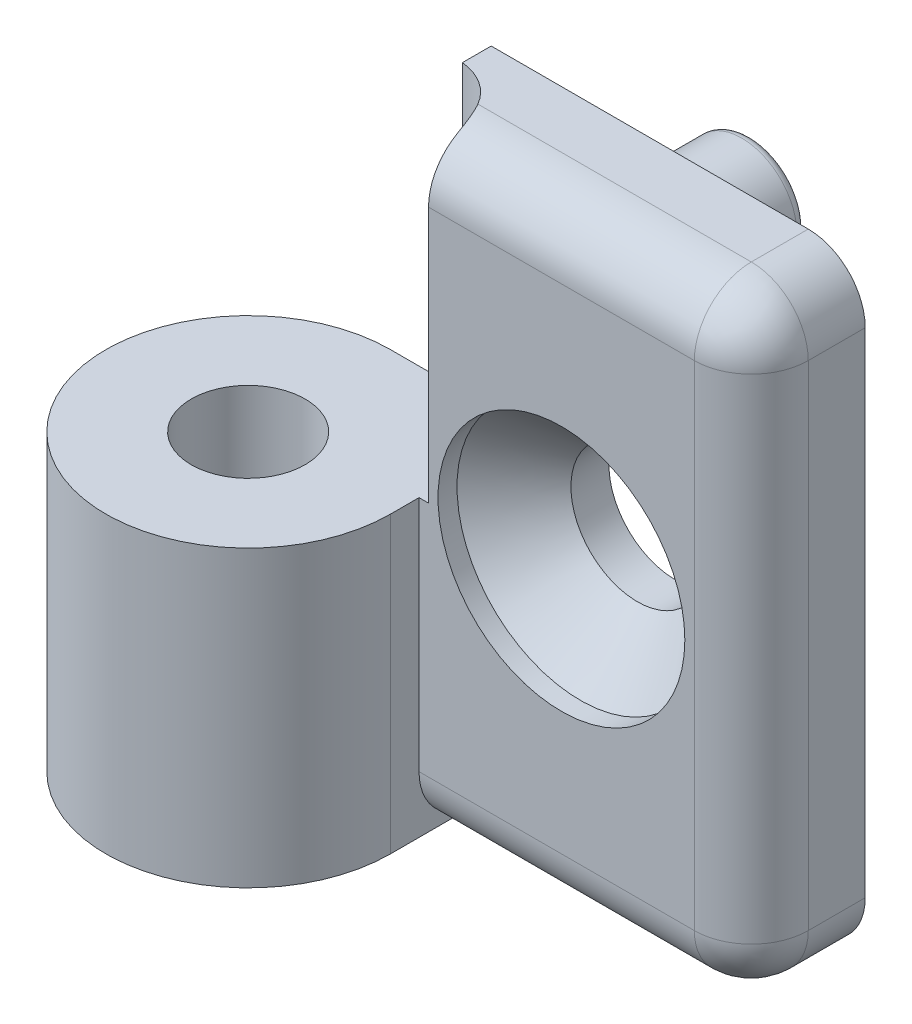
SolidWorks part; units mm, degrees
ref_plane "正面" through (0, 0, 0) normal (0, 0, 1) x (1, 0, 0)
ref_plane "平面" through (0, 0, 0) normal (0, 1, 0) x (1, 0, 0)
ref_plane "右側面" through (0, 0, 0) normal (1, 0, 0) x (0, 0, -1)
sketch "ｽｹｯﾁ1" plane through (0, 0, 0) normal (0, 1, 0) x (1, 0, 0)
  line L11 (7.6, 7.5) -> (0, 7.5)
  line L12 (7.5, 0) -> (7.5, 1.5)
  line L13 (7.6, 7.5) -> (7.6, 1.5)
  line L14 (7.6, 1.5) -> (7.5, 1.5)
  arc A6 (0, 7.5) -> (7.5, 0) centre (0, 0) ccw
  dimension "D1" = 0.1
extrude "押し出し1" add sketch "ｽｹｯﾁ1" along normal blind 15.5
sketch "ｽｹｯﾁ2" plane through (0, 0, 0) normal (0, -1, 0) x (1, 0, 0)
  line L0 (5.3, -1.5) -> (5.3, -7.5)
  line L14 (25, -7.5) -> (5.3, -7.5)
  line L15 (22, -1.5) -> (5.3, -1.5)
  line L16 (25, -4.5) -> (25, -7.5)
  arc A2 (25, -4.5) -> (22, -1.5) centre (22, -4.5) ccw
  dimension "D1" = 3
  dimension "D2" = 6
  dimension "D4" = 5.3
extrude "押し出し10" add sketch "ｽｹｯﾁ2" against normal blind 32
hole_wizard "穴1" positions "3Dｽｹｯﾁ1" profile "ｽｹｯﾁ6" legacy
sketch3d "3Dｽｹｯﾁ1"
  line L2 (22, 32, -1.5) -> (5.3, 32, -1.5) construction
  line L5 (22, 32, -1.5) -> (22, 0, -1.5) construction
  point P2 (15, 16, -1.5)
  dimension "D4" = 7
  dimension "D3" = 16
sketch "ｽｹｯﾁ6" plane through (15, 16, -1.5) normal (1, 0, 0) x (0, -1, 0)
  line L0 (0, 0) -> (0, 6)
  line L1 (0, 6) -> (3.5, 6)
  line L2 (3.5, 6) -> (3.5, 4)
  line L3 (3.5, 4) -> (6.5, 1)
  line L4 (6.5, 1) -> (6.5, 0)
  line L6 (6.5, 0) -> (0, 0)
  line L7 (-3.5, 4) -> (-6.5, 1) construction
  line L11 (0, -6.35) -> (0, 107.95) construction
  dimension "通し穴の直径" = 7
  dimension "通し穴の深さ" = 6
  dimension "皿穴の直径" = 13
  dimension "皿穴の角度" = 90
  dimension "ねじのすきま" = 1
sketch "ｽｹｯﾁ8" plane through (0, 0, -7.5) normal (0, 0, -1) x (-1, 0, 0)
  line L1 (-25, 32) -> (-25, 0) construction
  circle A2 centre (-15, 4) radius 2.9
  circle A9 centre (-15, 28) radius 2.9
  dimension "D1" = 10
  dimension "D2" = 5.8
  dimension "D3" = 5.8
fillet "ﾌｨﾚｯﾄ1" radius 3 6 edges at (25, 32, -6) (24.1213, 32, -2.3787) (13.65, 32, -1.5) (25, 0, -6) (24.1213, 0, -2.3787) (14.75, 0, -1.5)
sketch "ｽｹｯﾁ9" plane through (0, 32, 0) normal (0, 1, 0) x (1, 0, 0)
  line L1 (25, 7.5) -> (25, 4.5) construction
  line L2 (22, 7.5) -> (5.3, 7.5) construction
  line L3 (8, 3) -> (8, 0)
  line L4 (5, 0) -> (8, 0)
  arc A0 (8, 3) -> (5, 0) centre (5, 3) ccw
  dimension "D1" = 6
  dimension "D2" = 20
  dimension "D3" = 4.5
extrude "ｶｯﾄ - 押し出し1" cut sketch "ｽｹｯﾁ9" against normal blind 16.5
sketch "ｽｹｯﾁ10" plane through (0, 15.5, 0) normal (0, 1, 0) x (1, 0, 0)
  circle A0 centre (0, 0) radius 3
  dimension "D1" = 6
extrude "ｶｯﾄ - 押し出し2" cut sketch "ｽｹｯﾁ10" against normal blind 13.5
extrude "ﾎﾞｽ - 押し出し1" add sketch "ｽｹｯﾁ8" along normal blind 4
fillet "ﾌｨﾚｯﾄ2" radius 0.5 2 edges at (12.1, 4, -11.5) (12.1, 28, -11.5)
sketch "ｽｹｯﾁ11" plane through (0, 0, -11.5) normal (0, 0, -1) x (-1, 0, 0)
  circle A0 centre (-15, 28) radius 2
  circle A1 centre (-15, 4) radius 2
  dimension "D1" = 4
  dimension "D2" = 4
extrude "ｶｯﾄ - 押し出し3" cut sketch "ｽｹｯﾁ11" against normal blind 7.5
